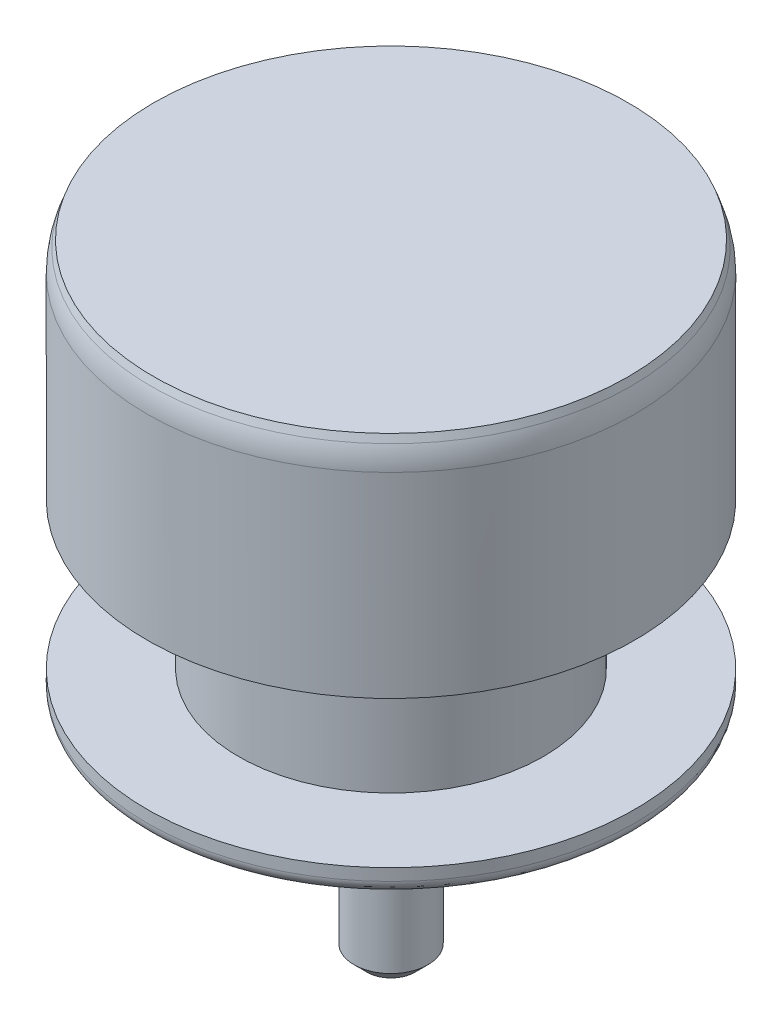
SolidWorks part; units mm, degrees
ref_plane "X_Y" through (0, 0, 0) normal (0, 0, 1) x (1, 0, 0)
ref_plane "Z_X" through (0, 0, 0) normal (0, 1, 0) x (1, 0, 0)
ref_plane "Y_Z" through (0, 0, 0) normal (1, 0, 0) x (0, 0, -1)
sketch "Sketch1" plane through (0, 0, 0) normal (0, 0, 1) x (1, 0, 0)
  line L0 (0, 0) -> (0, -9.6)
  line L2 (0.57, -7.8709) -> (3.76, -6.0292)
  line L3 (3.76, -6.0292) -> (3.76, -5.73)
  line L4 (3.76, -5.73) -> (2.35, -5.73)
  line L5 (2.35, -5.73) -> (2.35, -3.47)
  line L6 (2.35, -3.47) -> (3.76, -3.47)
  line L7 (3.76, -3.47) -> (3.76, -0.2747)
  line L8 (3.66, 0) -> (0, 0)
  line L10 (3.66, 0) -> (3.76, -0.2747)
  line L11 (0, -0.986) -> (0, -50000.986) construction
  line L12 (0.57, -7.8709) -> (0.57, -9.6)
  line L13 (0.57, -9.6) -> (0, -9.6)
  point P10 (0, -8.2)
  point P11 (2.35, -4.6)
  dimension "D1" = 6.0292
  dimension "D2" = 7.52
  dimension "D3" = 60
  dimension "D4" = 4.6
  dimension "D5" = 2.26
  dimension "D6" = 4.7
  dimension "D7" = 1.14
  dimension "D8" = 0.1
  dimension "D9" = 20
  dimension "D10" = 8.2
  dimension "D11" = 9.6
  dimension "D12" = 1.4
  dimension "D13" = 0.2992
revolve "Revolve1" add sketch "Sketch1" angle 360 about L0
fillet "Fillet1" radius 0.2 1 edges at (-3.76, -6.0292, 0)
fillet "Fillet2" radius 1 1 edges at (-3.76, -0.2747, 0)
chamfer "Chamfer1" distance 0.2 angle 45 1 edges at (-0.57, -9.6, 0)
